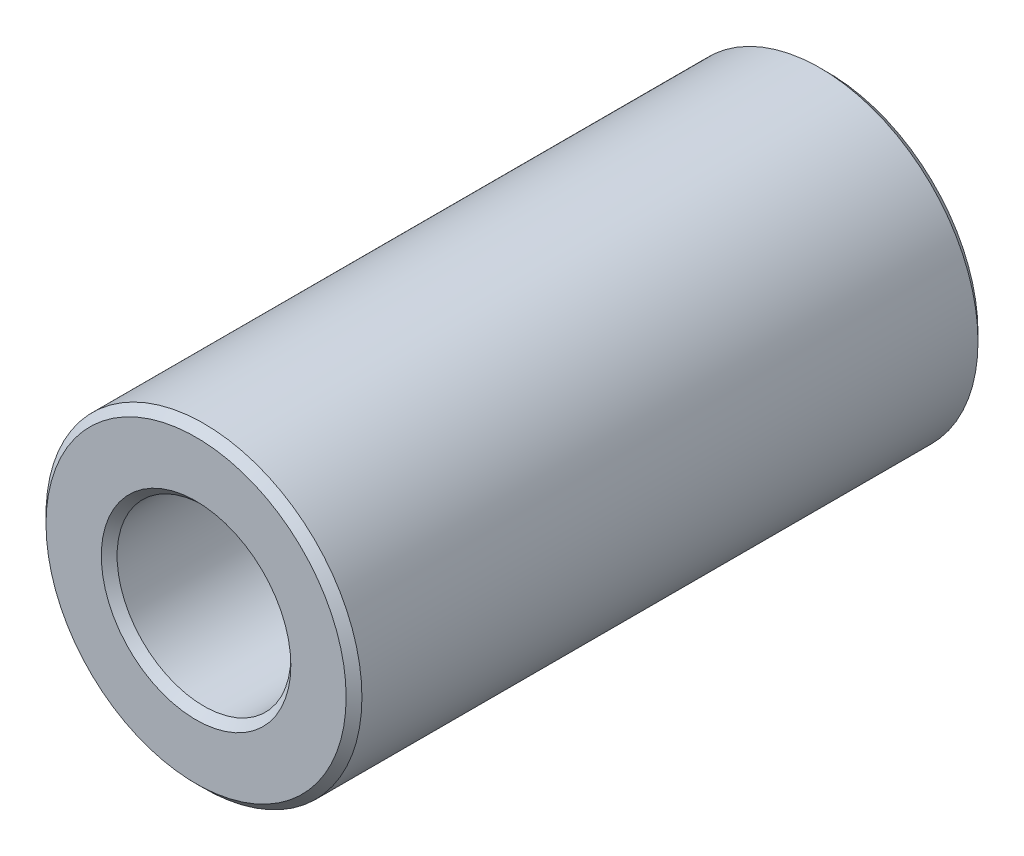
SolidWorks part; units mm, degrees
ref_plane "Front Plane" through (0, 0, 0) normal (0, 0, 1) x (1, 0, 0)
ref_plane "Top Plane" through (0, 0, 0) normal (0, 1, 0) x (1, 0, 0)
ref_plane "Right Plane" through (0, 0, 0) normal (1, 0, 0) x (0, 0, -1)
sketch "Sketch1" plane through (0, 0, 0) normal (0, 0, 1) x (1, 0, 0)
  circle A0 centre (0, 0) radius 2
  circle A1 centre (0, 0) radius 1.1
  dimension "D1" = 4
  dimension "D2" = 2.2
extrude "Boss-Extrude2" add sketch "Sketch1" along normal mid plane 8
chamfer "Chamfer3" distance 0.1 angle 45 4 edges at (2, 0, 4) (2, 0, -4) (1.1, 0, -4) (1.1, 0, 4)
